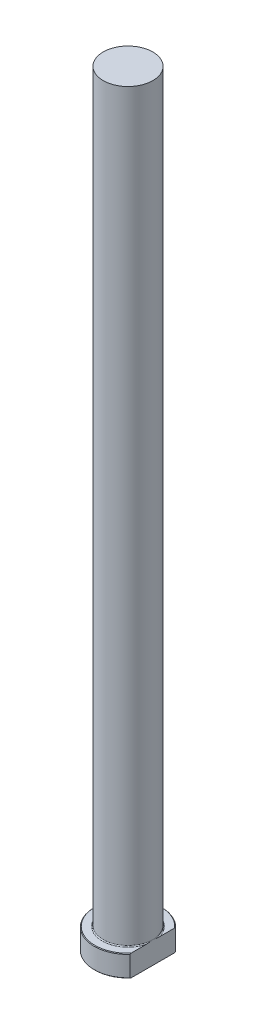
SolidWorks part; units mm, degrees
ref_plane "Front Plane" through (0, 0, 0) normal (0, 0, 1) x (1, 0, 0)
ref_plane "Top Plane" through (0, 0, 0) normal (0, 1, 0) x (1, 0, 0)
ref_plane "Right Plane" through (0, 0, 0) normal (1, 0, 0) x (0, 0, -1)
sketch "Sketch1" plane through (0, 0, 0) normal (0, 0, 1) x (1, 0, 0)
  line L0 (0, 259.9588) -> (0, -15.1925) construction
  line L1 (0, 0) -> (-11, 0)
  line L2 (-11, 0) -> (-11, 7)
  line L3 (-11, 7) -> (-8.1, 7)
  line L4 (-8.1, 7) -> (-8.1, 250)
  line L5 (-8.1, 250) -> (0, 250)
  line L6 (0, 250) -> (0, 0)
  dimension "L" = 250
  dimension "H" = 22
  dimension "T" = 7
  dimension "D" = 16.2
revolve "Revolve1" add sketch "Sketch1" angle 360 about L0
chamfer "Chamfer1" distance 0.2 angle 45 2 edges at (0, 7, 11) (0, 0, 11)
fillet "Fillet1" radius 0.3 1 edges at (0, 7, 8.1)
sketch "Sketch2" plane through (0, 0, 0) normal (0, 1, 0) x (1, 0, 0)
  line L0 (8.1, 7.4424) -> (8.1, -7.4424)
  circle A0 centre (0, 0) radius 11 construction
  arc A1 (8.1, -7.4424) -> (8.1, 7.4424) centre (0, 0) ccw
  circle A2 centre (0, 0) radius 8.1 construction
extrude "KEY" cut sketch "Sketch2" along normal through all
